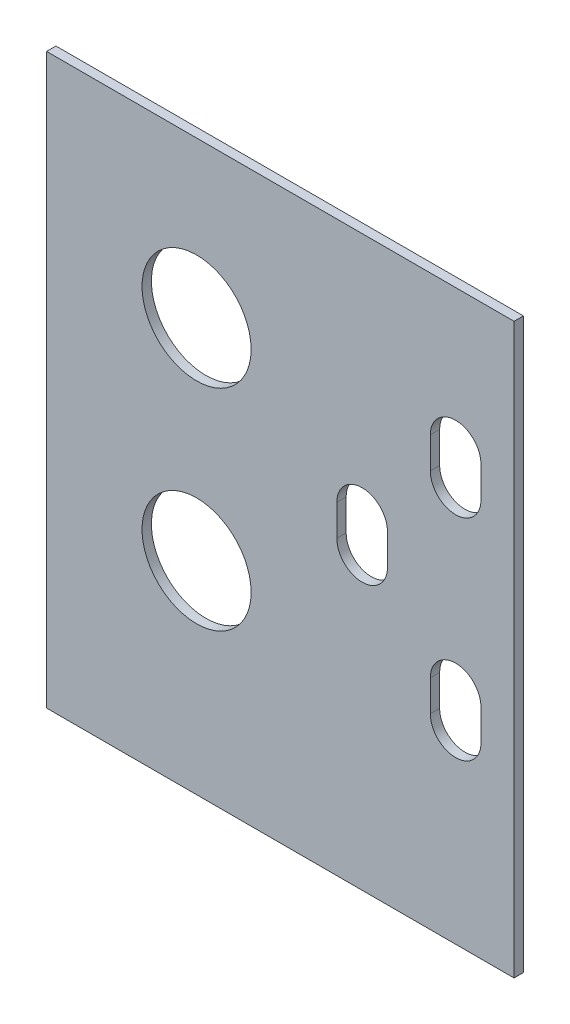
SolidWorks part; units mm, degrees
ref_plane "Plane1" through (0, 0, 0) normal (0, 0, 1) x (1, 0, 0)
ref_plane "Plane2" through (0, 0, 0) normal (0, 1, 0) x (1, 0, 0)
ref_plane "Plane3" through (0, 0, 0) normal (1, 0, 0) x (0, 0, -1)
sketch "Эскиз1" plane through (0, 0, 0) normal (0, 0, 1) x (1, 0, 0)
  line L1 (0, 0) -> (60, 0)
  line L2 (0, 0) -> (0, 73)
  line L3 (0, 73) -> (60, 73)
  line L4 (60, 0) -> (60, 73)
  dimension "D1" = 73
  dimension "D2" = 60
base flange "Базовая кромка1" sketch "Эскиз1" thickness 1.2 reverse thickness direction no parameters "D1"=1
sketch "Эскиз7" plane through (0, 0, 0) normal (0, 0, 1) x (1, 0, 0)
  line L0 (52.5, 55) -> (52.5, 51) construction
  line L1 (52.5, 51) -> (52.5, 28) construction
  line L2 (52.5, 28) -> (52.5, 24) construction
  line L3 (52.5, 39.5) -> (42.1087, 39.5) construction
  line L4 (40.5, 41.5) -> (40.5, 37.5) construction
  line L6 (43.75, 37.5) -> (43.75, 41.5)
  line L7 (37.25, 41.5) -> (37.25, 37.5)
  line L8 (49.25, 28) -> (49.25, 24)
  line L9 (55.75, 24) -> (55.75, 28)
  line L10 (49.25, 55) -> (49.25, 51)
  line L11 (55.75, 51) -> (55.75, 55)
  line L13 (60, 0) -> (60, 73) construction
  line L14 (60, 73) -> (0, 73) construction
  arc A6 (43.75, 41.5) -> (37.25, 41.5) centre (40.5, 41.5) ccw
  arc A7 (37.25, 37.5) -> (43.75, 37.5) centre (40.5, 37.5) ccw
  arc A8 (49.25, 24) -> (55.75, 24) centre (52.5, 24) ccw
  arc A9 (55.75, 28) -> (49.25, 28) centre (52.5, 28) ccw
  arc A10 (55.75, 55) -> (49.25, 55) centre (52.5, 55) ccw
  arc A11 (49.25, 51) -> (55.75, 51) centre (52.5, 51) ccw
  point P18 (0, 0)
  dimension "D1" = 3.25
  dimension "D5" = 7.5
  dimension "D7" = 12
  dimension "D2" = 4
  dimension "D3" = 13.5
  dimension "D4" = 27
  dimension "D6" = 18
  dimension "D8" = 12
extrude "Вырез-Вытянуть1" cut sketch "Эскиз7" against normal through all
sketch "Эскиз8" plane through (0, 0, 0) normal (0, 0, 1) x (1, 0, 0)
  line L0 (19.25, 53) -> (19.25, 26) construction
  line L1 (19.25, 39.5) -> (37.25, 39.5) construction
  line L2 (37.25, 41.5) -> (37.25, 37.5) construction
  circle A0 centre (19.25, 53) radius 7
  circle A1 centre (19.25, 26) radius 7
  dimension "D1" = 14
  dimension "D2" = 18
  dimension "D3" = 27
extrude "Вырез-Вытянуть2" cut sketch "Эскиз8" against normal through all
sketch "Сгиб-Линии1" [suppressed] plane through (0, 0, 0) normal (0, 1, 0) x (1, 0, 0)
sketch "Граничная рамка1" [suppressed] plane through (0, 0, 0) normal (0, 1, 0) x (1, 0, 0)
sheet metal parameters "Листовой металл5" thickness 1.2 parameters "D1"=1
flat pattern "Развертка5"
sketch "Сгиб-Линии2" plane through (0, 0, 0) normal (0, 1, 0) x (1, 0, 0)
sketch3d "Граничная рамка2" [suppressed]
  line L0 (60, 73, 0) -> (60, 0, 0) construction
  line L1 (0, 73, 0) -> (0, 0, 0) construction
  line L2 (60, 73, 0) -> (0, 73, 0) construction
  line L3 (60, 0, 0) -> (0, 0, 0) construction
sheet metal parameters "Листовой металл6" thickness 1.2 parameters "D1"=1
flat pattern "Развертка5"
sketch "Сгиб-Линии2" plane through (0, 0, 0) normal (0, 1, 0) x (1, 0, 0)
sketch3d "Граничная рамка2" [suppressed]
  line L0 (60, 73, 0) -> (60, 0, 0) construction
  line L1 (0, 73, 0) -> (0, 0, 0) construction
  line L2 (60, 73, 0) -> (0, 73, 0) construction
  line L3 (60, 0, 0) -> (0, 0, 0) construction
sheet metal parameters "Листовой металл7" thickness 1.2 parameters "D1"=1
flat pattern "Развертка5"
sketch "Сгиб-Линии2" plane through (0, 0, 0) normal (0, 1, 0) x (1, 0, 0)
sketch3d "Граничная рамка2" [suppressed]
  line L0 (60, 73, 0) -> (60, 0, 0) construction
  line L1 (0, 73, 0) -> (0, 0, 0) construction
  line L2 (60, 73, 0) -> (0, 73, 0) construction
  line L3 (60, 0, 0) -> (0, 0, 0) construction
